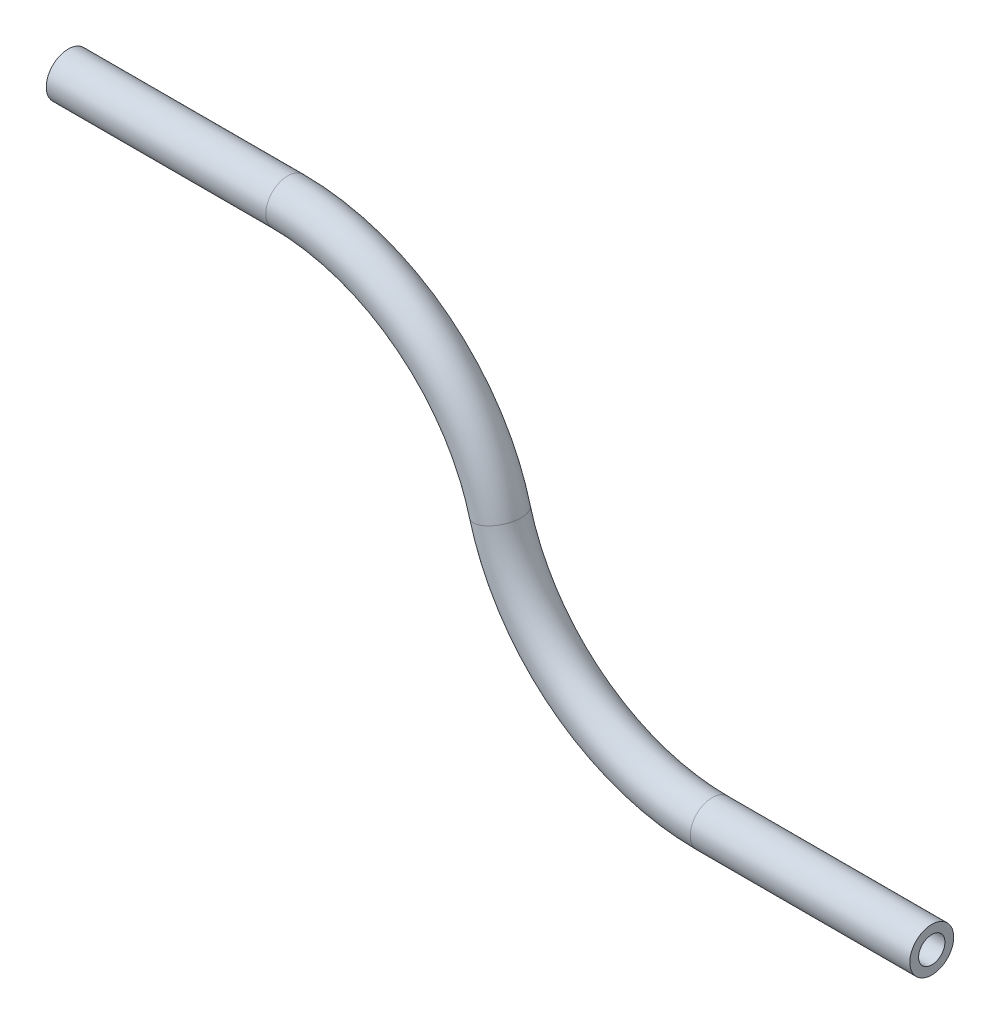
SolidWorks part; units mm, degrees
ref_plane "Face" through (0, 0, 0) normal (0, 0, 1) x (1, 0, 0)
ref_plane "Dessus" through (0, 0, 0) normal (0, 1, 0) x (1, 0, 0)
ref_plane "Droite" through (0, 0, 0) normal (1, 0, 0) x (0, 0, -1)
sketch "Esquisse1" plane through (0, 0, 0) normal (0, 0, 1) x (1, 0, 0)
  line L0 (0, 0) -> (50, 0)
  line L1 (146.6404, -74.2971) -> (196.6404, -74.2971)
  arc A0 (50, 0) -> (98.3202, -37.1485) centre (50, -50) cw
  arc A1 (98.3202, -37.1485) -> (146.6404, -74.2971) centre (146.6404, -24.2971) ccw
  dimension "D1" = 50
  dimension "D2" = 50
  dimension "D3" = 50
  dimension "D4" = 74.2971
sketch "Esquisse2" plane through (0, 0, 0) normal (1, 0, 0) x (0, 0, -1)
  circle A0 centre (0, 0) radius 5
  circle A1 centre (0, 0) radius 3
  dimension "D1" = 10
  dimension "D2" = 6
sweep "Balayage1" add profiles "Esquisse2" path "Esquisse1"
